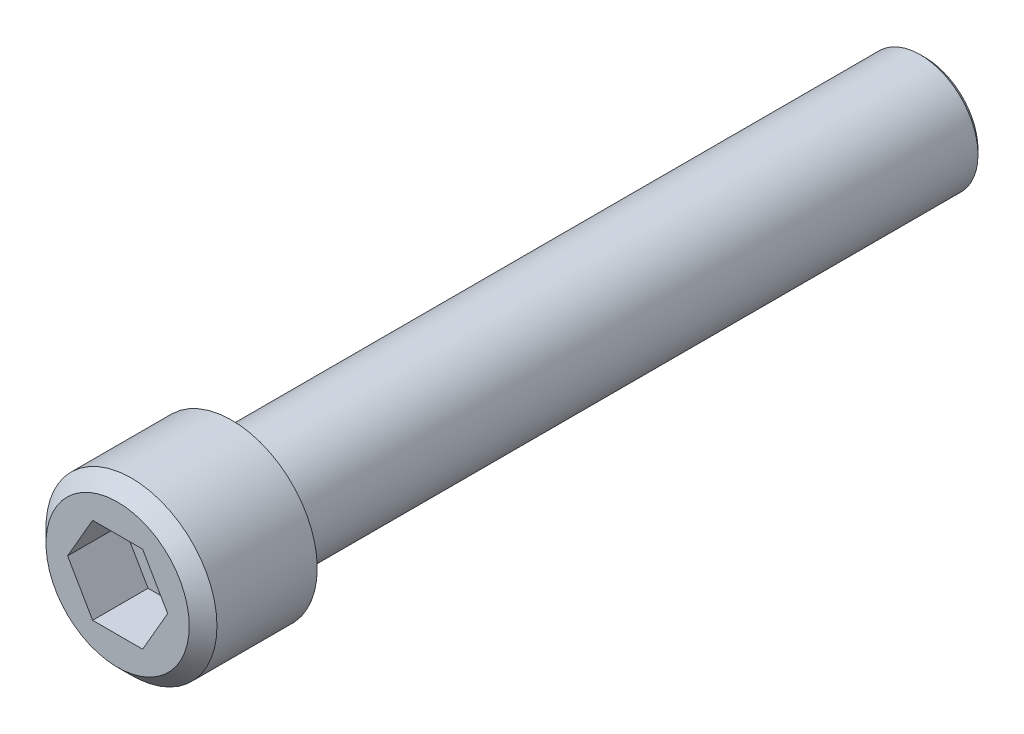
SolidWorks part; units mm, degrees
ref_plane "Plane1" through (0, 0, 0) normal (0, 0, 1) x (1, 0, 0)
ref_plane "Plane2" through (0, 0, 0) normal (0, 1, 0) x (1, 0, 0)
ref_plane "Plane3" through (0, 0, 0) normal (1, 0, 0) x (0, 0, -1)
sketch "Sketch1" plane through (0, 0, 0) normal (0, 0, 1) x (1, 0, 0)
  circle A0 centre (0, 0) radius 4.699
  dimension "Head Dia." = 9.398
extrude "Head" add sketch "Sketch1" against normal blind 6.2738
sketch "Sketch2" plane through (0, 0, -6.2738) normal (0, 0, -1) x (-1, 0, 0)
  circle A0 centre (0, 0) radius 3.175
  dimension "Shaft O.D." = 6.35
extrude "Shank" add sketch "Sketch2" along normal blind 38.1
sketch "Sketch3" plane through (0, 0, 0) normal (0, 0, 1) x (1, 0, 0)
  line L1 (2.7496, 0) -> (1.3748, 2.3813)
  line L2 (1.3748, 2.3813) -> (-1.3748, 2.3813)
  line L3 (-1.3748, 2.3813) -> (-2.7496, 0)
  line L4 (-2.7496, 0) -> (-1.3748, -2.3813)
  line L5 (-1.3748, -2.3813) -> (1.3748, -2.3813)
  line L6 (1.3748, -2.3813) -> (2.7496, 0)
  circle A0 centre (0, 0) radius 2.3813 construction
  dimension "Socket Size" = 4.7625
extrude "Socket" cut sketch "Sketch3" against normal blind 3.048
chamfer "Bottom Chamfer" distance 0.254 angle 45 1 edges at (-3.175, 0, -44.3738)
chamfer "Top Chamfer" distance 0.762 angle 45 1 edges at (4.699, 0, 0)
